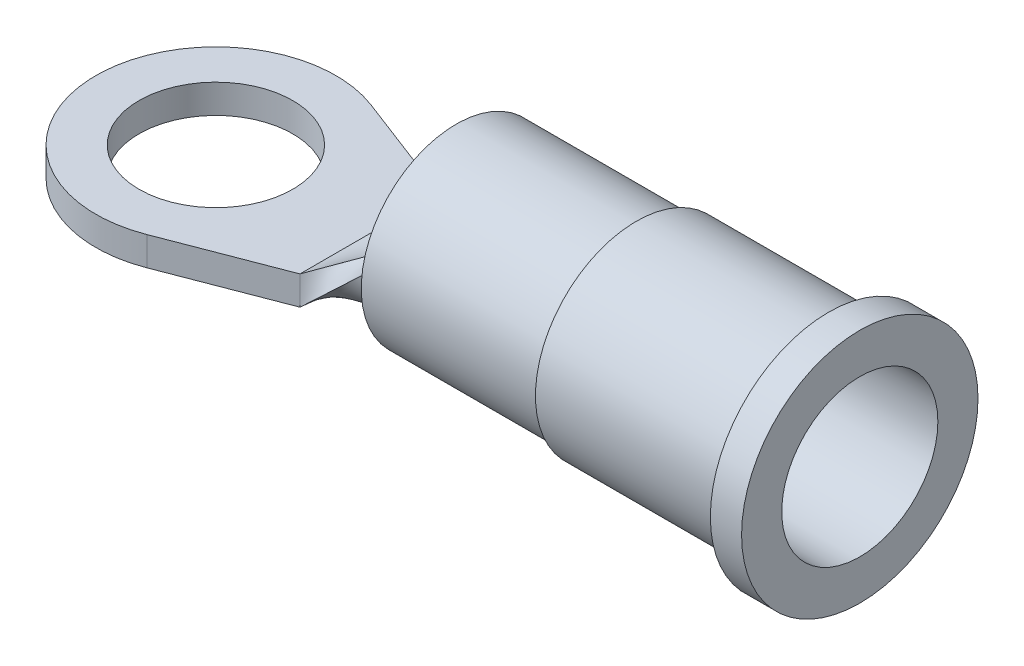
SolidWorks part; units mm, degrees
ref_plane "Front" through (0, 0, 0) normal (0, 0, 1) x (1, 0, 0)
ref_plane "Top" through (0, 0, 0) normal (0, 1, 0) x (1, 0, 0)
ref_plane "Right" through (0, 0, 0) normal (1, 0, 0) x (0, 0, -1)
sketch "Sketch1" plane through (0, 0, 0) normal (0, 1, 0) x (1, 0, 0)
  line L0 (0, 0) -> (4.064, 0) construction
  line L1 (4.064, 1.8415) -> (4.064, -1.8415)
  line L2 (4.064, 1.8415) -> (1.1373, 2.9643)
  line L3 (4.064, -1.8415) -> (1.1373, -2.9643)
  arc A0 (1.1373, 2.9643) -> (1.1373, -2.9643) centre (0, 0) ccw
  circle A1 centre (0, 0) radius 2.032
  point P8 (4.064, 0)
  dimension "D1" = 6.35
  dimension "D2" = 4.064
  dimension "D3" = 4.064
  dimension "D4" = 3.683
extrude "Extrude1" add sketch "Sketch1" against normal blind 0.762
ref_plane "Plane1" through (6.35, 0, 0) normal (1, 0, 0) x (0, 0, -1)
sketch "Sketch2" plane through (6.35, 0, 0) normal (1, 0, 0) x (0, 0, -1)
  line L0 (-1.8415, -0.762) -> (1.8415, -0.762) construction
  line L1 (0, 3.4366) -> (0, -3.4366) construction
  circle A0 centre (0, 1.143) radius 0.889
  circle A1 centre (0, 1.143) radius 1.905
  dimension "D1" = 1.778
  dimension "D2" = 3.81
extrude "Extrude2" add sketch "Sketch2" along normal blind 6.35
sketch "Sketch3" plane through (6.35, 0, 0) normal (-1, 0, 0) x (0, 0, 1)
  line L0 (-1.888, 1.397) -> (-0.8519, 1.397)
  line L1 (-3.175, -0.762) -> (3.175, -0.762) construction
  line L2 (0.8519, 1.397) -> (1.888, 1.397)
  circle A0 centre (0, 1.143) radius 0.889 construction
  circle A1 centre (0, 1.143) radius 1.905
  arc A2 (-1.888, 1.397) -> (1.888, 1.397) centre (0, 1.143) ccw
  arc A3 (-0.8519, 1.397) -> (0.8519, 1.397) centre (0, 1.143) ccw
  dimension "D2" = 2.159
  dimension "D1" = 0
sketch "Sketch4" plane through (4.064, 0, 0) normal (1, 0, 0) x (0, 0, -1)
  line L4 (1.8415, 0) -> (-1.8415, 0)
  line L5 (-1.8415, 0) -> (-1.8415, -0.762)
  line L6 (-1.8415, -0.762) -> (1.8415, -0.762)
  line L7 (1.8415, -0.762) -> (1.8415, 0)
  line L8 (1.8415, 0) -> (-1.8415, 0)
  line L9 (-1.8415, 0) -> (-1.8415, -0.762)
  line L10 (-1.8415, -0.762) -> (1.8415, -0.762)
  line L11 (1.8415, -0.762) -> (1.8415, 0)
  dimension "D1" = 0
sketch "Sketch5" plane through (0, -0.762, 0) normal (0, 1, 0) x (1, 0, 0)
  line L0 (4.064, 0) -> (6.35, 0)
  line L1 (4.064, -1.8415) -> (4.064, 1.8415) construction
  line L2 (6.35, 1.905) -> (6.35, -1.905) construction
loft "Loft3" add profiles "Sketch3", "Sketch4"
sketch "Sketch7" plane through (0, 0, 0) normal (0, 0, 1) x (1, 0, 0)
  line L0 (13.1724, 1.143) -> (5.6499, 1.143) construction
  line L1 (12.7, 1.143) -> (6.35, 1.143) construction
  line L2 (6.35, 3.6512) -> (11.1125, 3.6512)
  line L3 (6.35, 3.048) -> (6.35, 1.397) construction
  line L4 (11.1125, 3.81) -> (16.1925, 3.81)
  line L5 (11.1125, 3.81) -> (11.1125, 3.6512)
  line L7 (12.7, 3.048) -> (6.35, 3.048) construction
  line L8 (12.7, 3.048) -> (6.35, 3.048)
  line L9 (6.35, 3.6512) -> (6.35, 3.048)
  line L10 (12.7, 3.048) -> (12.7, 3.2067)
  line L11 (12.7, 3.2067) -> (17.018, 3.2067)
  line L12 (17.018, 3.2067) -> (17.018, 4.2672)
  line L13 (16.1925, 4.2672) -> (17.018, 4.2672)
  line L14 (16.1925, 3.81) -> (16.1925, 4.2672)
  line L15 (0, -0.762) -> (0, 0) construction
  dimension "D1" = 5.0165
  dimension "D2" = 4.7625
  dimension "D3" = 5.334
  dimension "D4" = 17.018
  dimension "D5" = 6.2484
  dimension "D6" = 0.8255
revolve "Housing" add sketch "Sketch7" angle 360 about L0
